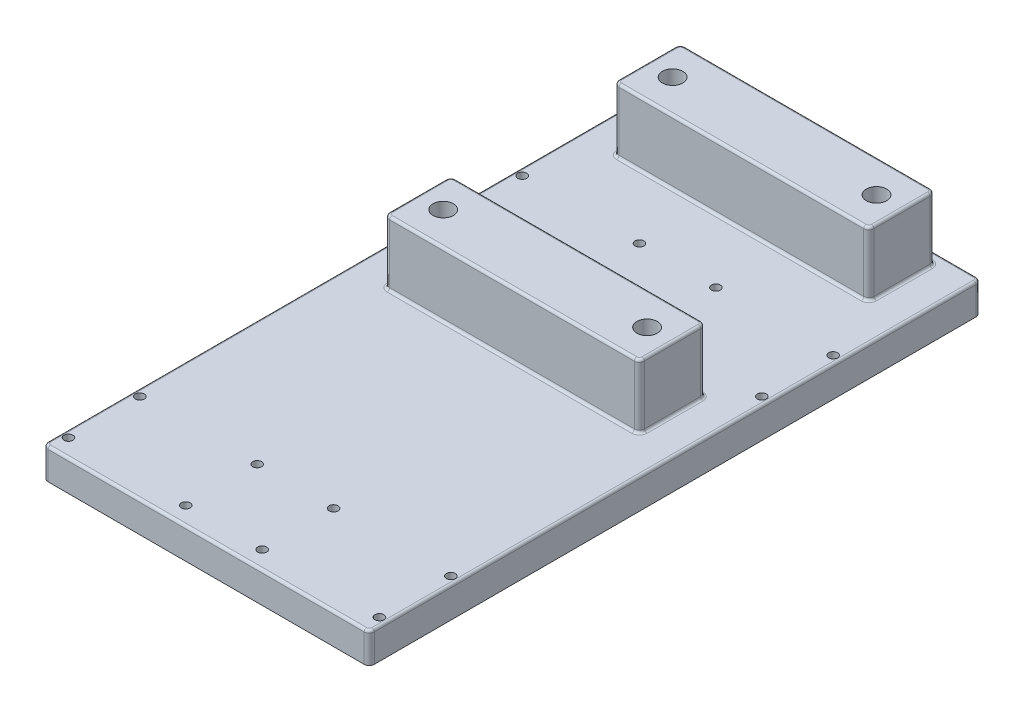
SolidWorks part; units mm, degrees
ref_plane "front" through (0, 0, 0) normal (0, 0, 1) x (1, 0, 0)
ref_plane "top" through (0, 0, 0) normal (0, 1, 0) x (1, 0, 0)
ref_plane "side" through (0, 0, 0) normal (1, 0, 0) x (0, 0, -1)
sketch "Sketch1" plane through (0, 0, 0) normal (0, 1, 0) x (1, 0, 0)
  line L0 (0, 0) -> (0, -121.29) construction
  line L1 (-101.6, 0) -> (101.6, 0)
  line L2 (101.6, 0) -> (101.6, -381)
  line L3 (101.6, -381) -> (-101.6, -381)
  line L4 (-101.6, 0) -> (-101.6, -381)
  point P8 (0, 0)
  dimension "D1" = 381
  dimension "D2" = 203.2
extrude "Base-Extrude" add sketch "Sketch1" along normal blind 19.05
sketch "Sketch2" plane through (0, 19.05, 0) normal (0, 1, 0) x (-1, 0, 0)
  line L0 (79.375, 6.35) -> (-79.375, 6.35)
  line L1 (79.375, 6.35) -> (79.375, 47.625)
  line L2 (-79.375, 47.625) -> (79.375, 47.625)
  line L3 (-79.375, 47.625) -> (-79.375, 6.35)
  line L4 (0, 6.35) -> (0, 0) construction
  line L5 (101.6, 0) -> (-101.6, 0) construction
  dimension "D1" = 41.275
  dimension "D2" = 158.75
  dimension "D3" = 6.35
extrude "Boss-Extrude1" add sketch "Sketch2" along normal blind 39.6875
sketch "Sketch4" plane through (0, 58.7375, 0) normal (0, 1, 0) x (-1, 0, 0)
  line L0 (-79.375, 26.9875) -> (79.375, 26.9875) construction
  line L1 (-79.375, 47.625) -> (-79.375, 6.35) construction
  line L2 (79.375, 6.35) -> (79.375, 47.625) construction
  line L3 (0, 26.9875) -> (0, 42.4643) construction
  circle A0 centre (-63.5, 26.9875) radius 6.35
  circle A1 centre (63.5, 26.9875) radius 6.35
  dimension "D1" = 12.7
  dimension "D2" = 127
extrude "Cut-Extrude1" cut sketch "Sketch4" against normal blind 38.1
pattern_linear "LPattern1" count 2 spacing 142.875 along (0, 0, 1) of "Boss-Extrude1", "Cut-Extrude1"
ref_plane "Plane4" through (0, 0, 26.9875) normal (0, 0, 1) x (1, 0, 0)
sketch "Sketch5" plane through (0, 0, 0) normal (0, -1, 0) x (1, 0, 0)
  line L0 (96.8375, 369.8875) -> (-96.8375, 369.8875) construction
  line L1 (96.8375, 369.8875) -> (96.8375, 87.3125) construction
  line L2 (96.8375, 87.3125) -> (-96.8375, 87.3125) construction
  line L3 (-96.8375, 87.3125) -> (-96.8375, 369.8875) construction
  line L4 (-96.8375, 325.4375) -> (96.8375, 325.4375) construction
  line L5 (-96.8375, 131.7625) -> (96.8375, 131.7625) construction
  line L7 (101.6, 381) -> (-101.6, 381) construction
  line L8 (-101.6, 0) -> (-101.6, 381) construction
  line L9 (23.8125, 369.8875) -> (23.8125, 87.3125) construction
  line L10 (-23.8125, 369.8875) -> (-23.8125, 87.3125) construction
  circle A4 centre (96.8375, 87.3125) radius 2.7781
  circle A5 centre (96.8375, 131.7625) radius 2.7781
  circle A6 centre (96.8375, 369.8875) radius 2.7781
  circle A7 centre (96.8375, 325.4375) radius 2.7781
  circle A10 centre (23.8125, 87.3125) radius 2.7781
  circle A11 centre (23.8125, 131.7625) radius 2.7781
  circle A16 centre (-96.8375, 325.4375) radius 2.7781
  circle A17 centre (-96.8375, 369.8875) radius 2.7781
  circle A18 centre (-23.8125, 369.8875) radius 2.7781
  circle A19 centre (-23.8125, 325.4375) radius 2.7781
  circle A24 centre (-96.8375, 87.3125) radius 2.7781
  circle A25 centre (-96.8375, 131.7625) radius 2.7781
  circle A26 centre (-23.8125, 131.7625) radius 2.7781
  circle A27 centre (-23.8125, 87.3125) radius 2.7781
  circle A30 centre (23.8125, 369.8875) radius 2.7781
  circle A31 centre (23.8125, 325.4375) radius 2.7781
  dimension "D7" = 5.5562
  dimension "D1" = 11.1125
  dimension "D2" = 4.7625
  dimension "D3" = 44.45
  dimension "D4" = 73.025
  dimension "D5" = 120.65
  dimension "D6" = 73.025
  dimension "D8" = 44.45
  dimension "D9" = 238.125
  dimension "D10" = 44.45
extrude "Cut-Extrude2" cut sketch "Sketch5" against normal through all
fillet "Fillet1" radius 3.175 12 edges at (-79.375, 38.8937, 6.35) (-79.375, 38.8937, 47.625) (79.375, 38.8937, 47.625) (79.375, 38.8937, 6.35) (-79.375, 38.8937, 149.225) (-79.375, 38.8937, 190.5) (79.375, 38.8937, 190.5) (79.375, 38.8937, 149.225) (101.6, 9.525, 0) (-101.6, 9.525, 0) (-101.6, 9.525, 381) (101.6, 9.525, 381)
fillet "Fillet2" radius 1.5875 40 edges at (0, 19.05, 381) (-101.6, 19.05, 190.5) (0, 19.05, 47.625) (-79.375, 19.05, 26.9875) (0, 19.05, 6.35) (79.375, 19.05, 26.9875) (101.6, 19.05, 190.5) (0, 19.05, 0) (0, 19.05, 190.5) (-79.375, 19.05, 169.8625) (0, 19.05, 149.225) (79.375, 19.05, 169.8625) (-100.6701, 19.05, 0.9299) (100.6701, 19.05, 0.9299) (100.6701, 19.05, 380.0701) (-100.6701, 19.05, 380.0701) (-79.375, 58.7375, 26.9875) (0, 58.7375, 6.35) (0, 58.7375, 47.625) (79.375, 58.7375, 26.9875) (-78.4451, 58.7375, 46.6951) (78.4451, 58.7375, 46.6951) (78.4451, 58.7375, 7.2799) (-78.4451, 58.7375, 7.2799) (0, 58.7375, 190.5) (-79.375, 58.7375, 169.8625) (79.375, 58.7375, 169.8625) (0, 58.7375, 149.225) (78.4451, 58.7375, 189.5701) (78.4451, 58.7375, 150.1549) (-78.4451, 58.7375, 150.1549) (-78.4451, 58.7375, 189.5701) (-78.4451, 19.05, 7.2799) (78.4451, 19.05, 7.2799) (78.4451, 19.05, 46.6951) (-78.4451, 19.05, 46.6951) (-78.4451, 19.05, 189.5701) (-78.4451, 19.05, 150.1549) (78.4451, 19.05, 150.1549) (78.4451, 19.05, 189.5701)
